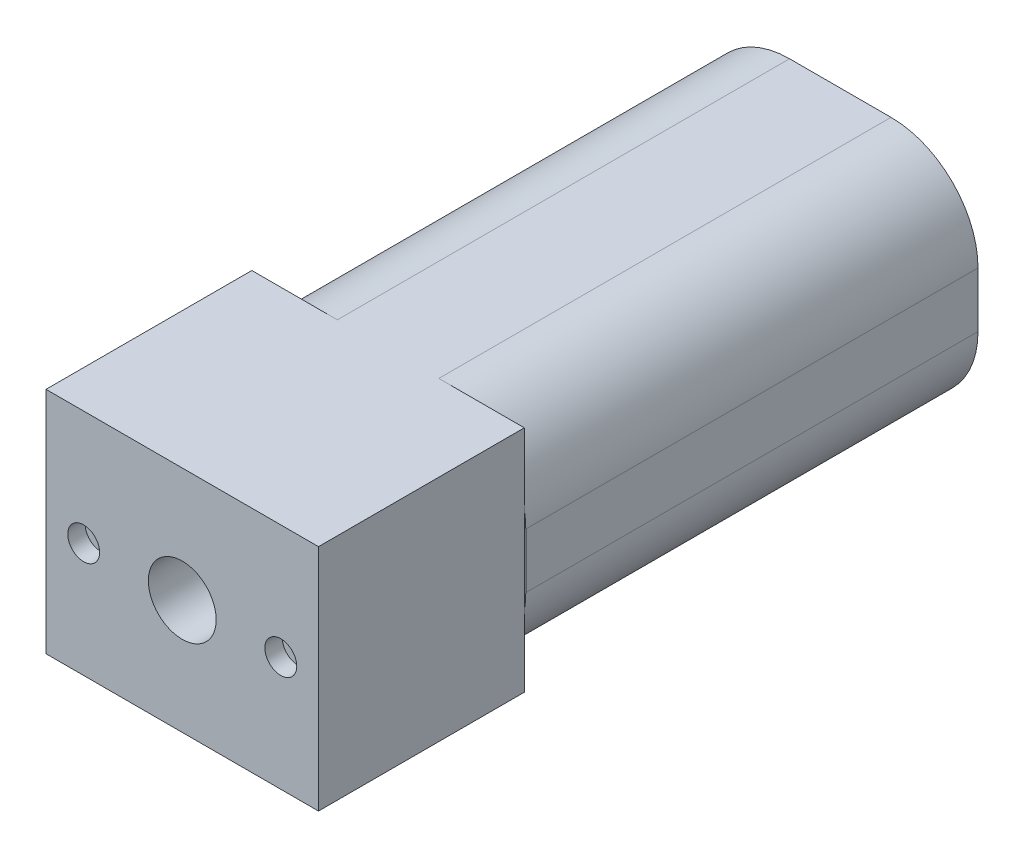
SolidWorks part; units mm, degrees
ref_plane "Front Plane" through (0, 0, 0) normal (0, 0, 1) x (1, 0, 0)
ref_plane "Top Plane" through (0, 0, 0) normal (0, 1, 0) x (1, 0, 0)
ref_plane "Right Plane" through (0, 0, 0) normal (1, 0, 0) x (0, 0, -1)
sketch "Sketch1" plane through (0, 0, 0) normal (0, 0, 1) x (1, 0, 0)
  line L1 (-2.2225, -5.0165) -> (2.2225, -5.0165)
  line L2 (-6.0325, -1.2065) -> (-6.0325, 1.2065)
  line L3 (-2.2225, 5.0165) -> (2.2225, 5.0165)
  line L4 (6.0325, -1.2065) -> (6.0325, 1.2065)
  line L5 (-6.0325, -5.0165) -> (6.0325, 5.0165) construction
  line L6 (-6.0325, 5.0165) -> (6.0325, -5.0165) construction
  arc A0 (-6.0325, 1.2065) -> (-2.2225, 5.0165) centre (-2.2225, 1.2065) cw
  arc A1 (-2.2225, -5.0165) -> (-6.0325, -1.2065) centre (-2.2225, -1.2065) cw
  arc A2 (2.2225, -5.0165) -> (6.0325, -1.2065) centre (2.2225, -1.2065) ccw
  arc A3 (2.2225, 5.0165) -> (6.0325, 1.2065) centre (2.2225, 1.2065) cw
  point P0 (0, 0)
  dimension "D3" = 3.81
  dimension "D1" = 12.065
  dimension "D2" = 10.033
extrude "Boss-Extrude1" add sketch "Sketch1" along normal blind 19.812
sketch "Sketch2" plane through (0, 0, 19.812) normal (0, 0, 1) x (1, 0, 0)
  line L1 (5.969, 5.0165) -> (-5.969, 5.0165)
  line L2 (5.969, 5.0165) -> (5.969, -5.0165)
  line L3 (5.969, -5.0165) -> (-5.969, -5.0165)
  line L4 (-5.969, 5.0165) -> (-5.969, -5.0165)
  line L5 (5.969, 5.0165) -> (-5.969, -5.0165) construction
  line L6 (5.969, -5.0165) -> (-5.969, 5.0165) construction
  point P0 (0, 0)
  dimension "D1" = 10.033
  dimension "D2" = 11.938
extrude "Boss-Extrude2" add sketch "Sketch2" along normal blind 9.017
sketch "Sketch3" plane through (0, 0, 28.829) normal (0, 0, 1) x (1, 0, 0)
  circle A0 centre (0, 0) radius 1.4859
  dimension "D1" = 2.9718
extrude "Cut-Extrude1" cut sketch "Sketch3" against normal blind 7.62
sketch "Sketch4" plane through (0, 0, 28.829) normal (0, 0, 1) x (1, 0, 0)
  circle A0 centre (-4.318, 0) radius 0.6985
  circle A1 centre (4.318, 0) radius 0.6985
  point P4 (0, 0)
  dimension "D1" = 4.318
  dimension "D3" = 1.397
  dimension "D2" = 8.636
extrude "Cut-Extrude2" cut sketch "Sketch4" against normal blind 0.762
